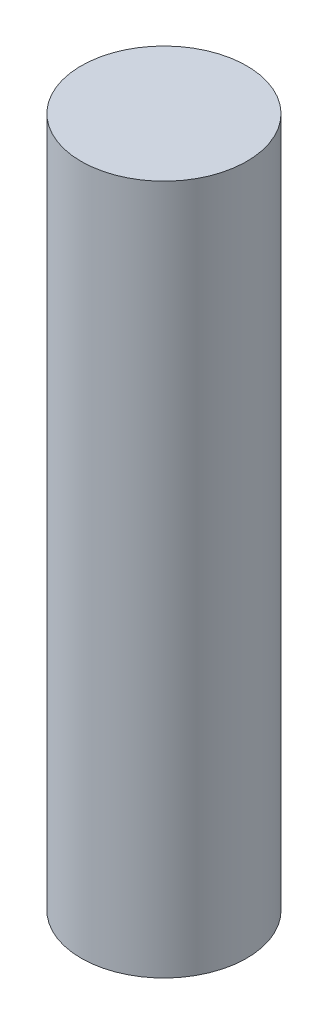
SolidWorks part; units mm, degrees
ref_plane "Front Plane" through (0, 0, 0) normal (0, 0, 1) x (1, 0, 0)
ref_plane "Top Plane" through (0, 0, 0) normal (0, 1, 0) x (1, 0, 0)
ref_plane "Right Plane" through (0, 0, 0) normal (1, 0, 0) x (0, 0, -1)
sketch "Sketch1" plane through (0, 0, 0) normal (0, 1, 0) x (1, 0, 0)
  circle A0 centre (0, 0) radius 1.5
  dimension "D1" = 3
extrude "Boss-Extrude1" add sketch "Sketch1" along normal blind 12.5 contours A0
